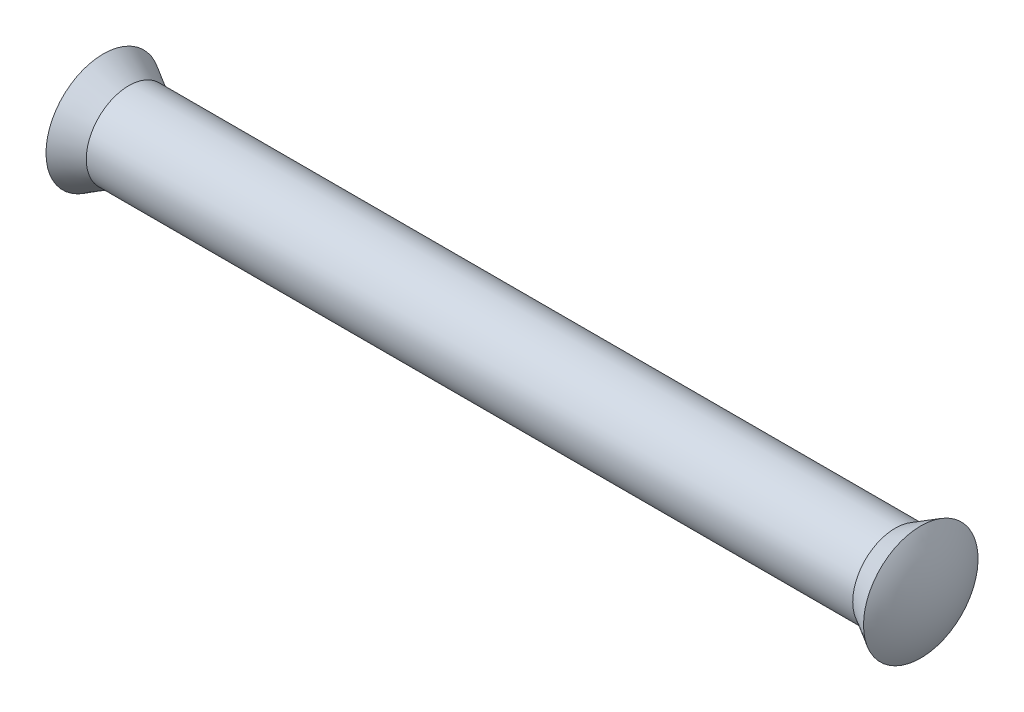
SolidWorks part; units mm, degrees
ref_plane "Спереди" through (0, 0, 0) normal (0, 0, 1) x (1, 0, 0)
ref_plane "Сверху" through (0, 0, 0) normal (0, 1, 0) x (1, 0, 0)
ref_plane "Справа" through (0, 0, 0) normal (1, 0, 0) x (0, 0, -1)
sketch "Эскиз1" plane through (0, 0, 0) normal (0, 0, 1) x (1, 0, 0)
  line L0 (0, 0) -> (90.3779, 0) construction
  line L1 (0.9996, 3.4199) -> (2.5236, 2.54)
  line L2 (2.5236, 2.54) -> (48.2944, 2.54)
  line L3 (48.2944, 2.54) -> (49.8184, 3.4199)
  line L4 (0, 0) -> (50.818, 0)
  arc A0 (0, 0) -> (0.9996, 3.4199) centre (6.35, 0) cw
  arc A1 (50.818, 0) -> (49.8184, 3.4199) centre (44.468, 0) ccw
  dimension "D6" = 6.35
  dimension "D7" = 48.8188
  dimension "D1" = 30
  dimension "D2" = 30
  dimension "D3" = 5.08
  dimension "D4" = 1.524
  dimension "D5" = 1.524
revolve "Повернуть1" add sketch "Эскиз1" angle 360 about L0
